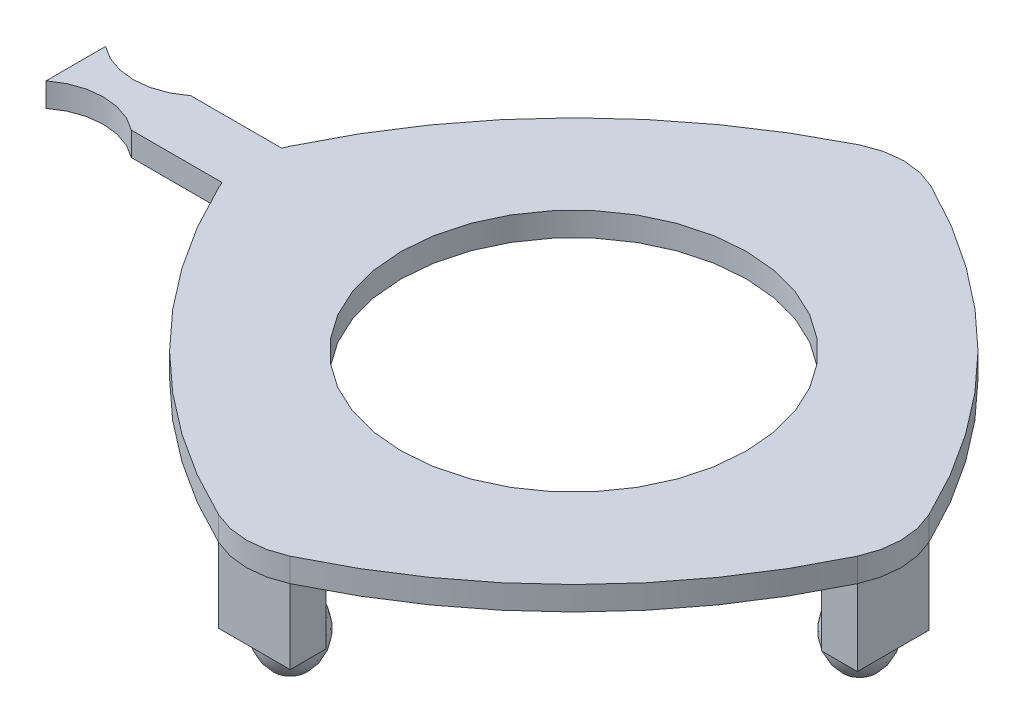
SolidWorks part; units mm, degrees
ref_plane "Front Plane" through (0, 0, 0) normal (0, 0, 1) x (1, 0, 0)
ref_plane "Top Plane" through (0, 0, 0) normal (0, 1, 0) x (1, 0, 0)
ref_plane "Right Plane" through (0, 0, 0) normal (1, 0, 0) x (0, 0, -1)
sketch "Sketch1" plane through (0, 0, 0) normal (0, 1, 0) x (1, 0, 0)
  circle A0 centre (0, 0) radius 24
  circle A1 centre (0, 0) radius 16
  dimension "D1" = 48
extrude "Boss-Extrude1" add sketch "Sketch1" along normal blind 2
sketch "Sketch2" plane through (0, 2, 0) normal (0, 1, 0) x (1, 0, 0)
  line L0 (0, 0) -> (0, -24) construction
  line L1 (-24, 0) -> (-24, -3) construction
  line L2 (-24, 0) -> (-24, 3) construction
  line L3 (-3, -24) -> (-3, -23.8118) construction
  line L4 (3, -24) -> (3, -23.8118) construction
  line L5 (3, -23.8118) -> (3, -26.8118)
  line L6 (-3, -23.8118) -> (-3, -26.8118)
  line L7 (-3, -26.8118) -> (3, -26.8118)
  line L8 (0, 0) -> (-24, 0) construction
  line L9 (-24, 0) -> (24, 0) construction
  line L10 (24, 0) -> (24, -3) construction
  line L11 (24, 0) -> (24, 3) construction
  line L12 (24, -3) -> (-24, -3) construction
  line L13 (24, 3) -> (-24, 3) construction
  line L14 (23.8118, -3) -> (26.8118, -3)
  line L15 (23.8118, 3) -> (26.8118, 3)
  line L16 (26.8118, 3) -> (26.8118, -3)
  line L17 (-23.8118, -3) -> (-26.8118, -3)
  line L18 (-26.8118, -3) -> (-26.8118, 3)
  line L19 (-26.8118, 3) -> (-23.7753, 3)
  line L20 (3, 23.8118) -> (3, 26.8118)
  line L21 (-3, 26.8118) -> (3, 26.8118)
  line L22 (-3, 23.8118) -> (-3, 26.8118)
  line L23 (0, 24) -> (0, 0) construction
  arc A0 (24, 0) -> (23.8118, 3) centre (0, 0) ccw
  arc A1 (-3, -23.8118) -> (3, -23.8118) centre (0, 0) ccw
  arc A2 (-3, -23.8118) -> (3, -23.8118) centre (0, 0) ccw
  arc A3 (-23.8118, 3) -> (-24, 0) centre (0, 0) ccw
  arc A4 (23.8118, -3) -> (23.8118, 3) centre (0, 0) ccw
  arc A5 (23.8118, -3) -> (22.9513, 7.0169) centre (0, 0) ccw
  arc A6 (-23.8118, 3) -> (3, -23.8118) centre (0, 0) ccw
  arc A7 (3, 23.8118) -> (-3, 23.8118) centre (0, 0) ccw
  arc A8 (3, 23.8118) -> (-3, 23.8118) centre (0, 0) ccw
  arc A9 (3, 23.8118) -> (-3, 23.8118) centre (0, 0) ccw
  arc A10 (3, 23.8118) -> (-3, 23.8118) centre (0, 0) ccw
  arc A11 (-23.8118, 3) -> (22.9513, 7.0169) centre (0, 0) ccw
  arc A12 (-23.8118, 3) -> (-23.8118, -3) centre (0, 0) ccw
  dimension "D1" = 6
  dimension "D2" = 3
  dimension "D3" = 6
  dimension "D4" = 3
extrude "Boss-Extrude2" add sketch "Sketch2" against normal blind 5
sketch "Croquis1" plane through (0, 0, 0) normal (1, 0, 0) x (0, 0, -1)
  line L0 (-23.8118, -3) -> (-23.8118, -9.5)
  line L1 (-23.8118, -6.25) -> (-21.312, -6.25) construction
  line L2 (-23.8118, -9.5) -> (-23.8118, 5.1699) construction
  arc A0 (-23.8118, -9.5) -> (-23.8118, -3) centre (-24.6746, -6.25) ccw
  point P6 (-23.8118, -6.25)
  dimension "D1" = 6.5
  dimension "D2" = 2.4997
revolve "Revolución1" add sketch "Croquis1" angle 360 about L2
sketch3d "Croquis3D1"
  line L0 (-24, 0, 0) -> (-24, -3, 0) construction
  line L1 (-24, -3, 0) -> (-24, -9.5, 0)
  line L2 (-24, -6.25, 0) -> (-24, -6.25, 2.5) construction
  arc A0 (-23.8118, 0, -3) -> (-23.8118, 0, 3) centre (0, 0, 0) ccw construction
  arc A1 (-23.8118, -3, -3) -> (-23.8118, -3, 3) centre (0, -3, 0) ccw construction
  arc A2 (-24, -9.5, 0) -> (-24, -3, 0) centre (-24, -6.25, -0.8625) cw
  point P5 (0, 24, 0)
  point P9 (0, 21, 0)
  point P14 (-27.3625, -6.25, -0.8625)
revolve "Revolución2" add sketch "Croquis3D1" angle 360 about L1
sketch3d "Croquis3D2"
  line L0 (24, -6.25, 0) -> (24, -6.25, 2.5) construction
  line L1 (24, -3, 0) -> (24, -9.5, 0)
  line L2 (24, -3, 0) -> (24, 0, 0) construction
  arc A1 (23.8118, -3, 3) -> (23.8118, -3, -3) centre (0, -3, 0) ccw construction
  arc A2 (24, -9.5, 0) -> (24, -3, 0) centre (24, -6.25, -0.8625) cw
  arc A3 (23.8118, 0, 3) -> (23.8118, 0, -3) centre (0, 0, 0) ccw construction
  point P4 (20.6375, -6.25, -0.8625)
  point P9 (0, 21, 0)
  point P14 (0, 24, 0)
revolve "Revolución3" add sketch "Croquis3D2" angle 360 about L1
sketch "Croquis2" plane through (-3, 0, 0) normal (-1, 0, 0) x (0, 0, 1)
  line L0 (26.8118, -3) -> (23.8118, -3)
  line L1 (23.8118, -3) -> (23.8118, -6.25)
  line L2 (23.8118, -6.25) -> (26.8118, -6.25)
  line L3 (26.8118, -6.25) -> (26.8118, -3)
extrude "Saliente-Extruir1" add sketch "Croquis2" against normal blind 6
sketch "Croquis4" plane through (0, 0, -3) normal (0, 0, -1) x (-1, 0, 0)
  line L0 (26.8118, -3) -> (23.8118, -3)
  line L1 (23.8118, -3) -> (23.8118, -6.2446)
  line L2 (23.8118, -6.2446) -> (26.8118, -6.2446)
  line L3 (26.8118, -6.2446) -> (26.8118, -3)
extrude "Saliente-Extruir2" add sketch "Croquis4" against normal blind 6
sketch "Croquis6" plane through (0, 0, -3) normal (0, 0, -1) x (-1, 0, 0)
  line L0 (-26.8118, -3) -> (-23.8118, -3)
  line L1 (-23.8118, -3) -> (-26.8118, -3) construction
  line L2 (-23.8118, -3) -> (-23.8118, 0) construction
  line L3 (-23.8118, -3) -> (-23.8118, -6.3919)
  line L4 (-23.8118, -6.3919) -> (-26.8118, -6.3919)
  line L5 (-26.8118, -6.3919) -> (-26.8118, -3)
extrude "Saliente-Extruir3" add sketch "Croquis6" against normal blind 6
sketch "Croquis7" plane through (0, 2, 0) normal (0, 1, 0) x (1, 0, 0)
  line L4 (26.8118, 3) -> (26.8118, -3) construction
  arc A1 (3, -23.8118) -> (23.8118, -3) centre (0, 0) ccw construction
  arc A2 (23.8118, 3) -> (-23.8118, 3) centre (0, 0) ccw construction
  arc A3 (-23.8118, -3) -> (-3, -23.8118) centre (0, 0) ccw construction
  arc A4 (16.9706, -16.9706) -> (3, -26.8118) centre (-18.3891, 18.3891) cw
  arc A5 (3, -26.8118) -> (-3, -26.8118) centre (0, -20.472) cw
  arc A6 (-3, -26.8118) -> (-16.9706, -16.9706) centre (18.3891, 18.3891) cw
  arc A7 (-16.9706, -16.9706) -> (-26.8118, -3) centre (18.3891, 18.3891) cw
  arc A8 (-26.8118, -3) -> (-26.8118, 3) centre (-20.472, 0) cw
  arc A9 (-26.8118, 3) -> (-16.9706, 16.9706) centre (18.3891, -18.3891) cw
  arc A10 (16.9706, -16.9706) -> (26.8118, -3) centre (-18.3891, 18.3891) ccw
  arc A11 (26.8118, -3) -> (26.8118, 3) centre (20.472, 0) ccw
  arc A12 (26.8118, 3) -> (16.9706, 16.9706) centre (-18.3891, -18.3891) ccw
  arc A13 (-16.9706, 16.9706) -> (16.9706, 16.9706) centre (0, 0) ccw
extrude "Saliente-Extruir4" add sketch "Croquis7" against normal blind 2 contours A4 M5 M4 | A5 M3 | A6 M2 M1 | A10 M5 M6 | A11 M7 | A12 M8 M9 | A9 M10 M9 | A7 M1 M12 | A8 M11
sketch "Croquis8" plane through (0, 2, 0) normal (0, 1, 0) x (1, 0, 0)
  line L0 (-27.4857, 0) -> (-16, 0) construction
  line L2 (-27.4857, -2.5) -> (-16, -2.5)
  line L3 (-16, -2.5) -> (-16, 0)
  line L4 (-16, 0) -> (-16, 2.5)
  line L5 (-16, 2.5) -> (-34.651, 2.5)
  line L6 (-41.8163, 2.5) -> (-41.8163, -2.5)
  line L7 (-34.651, -2.5) -> (-27.4857, -2.5)
  arc A0 (-26.8118, 3) -> (-26.8118, -3) centre (-20.472, 0) ccw construction
  circle A1 centre (0, 0) radius 16 construction
  arc A2 (-34.651, -2.5) -> (-41.8163, -2.5) centre (-38.2336, -7.0299) ccw
  arc A3 (-34.651, 2.5) -> (-41.8163, 2.5) centre (-38.2336, 7.0091) cw
extrude "Saliente-Extruir5" add sketch "Croquis8" against normal blind 2
sketch "Croquis10" plane through (0, 0, 0) normal (0, -1, 0) x (-1, 0, 0)
  line L0 (0, 24) -> (0, 27) construction
  line L1 (3, 27) -> (-3, 27)
  line L2 (-3, 27) -> (-3, 23.8118)
  line L3 (3, 27) -> (3, 23.8118)
  arc A0 (16.9706, 16.9706) -> (-16.9706, 16.9706) centre (0, 0) ccw construction
  arc A1 (3, 23.8118) -> (-3, 23.8118) centre (0, 0) ccw
  point P9 (0, 27)
extrude "Saliente-Extruir6" add sketch "Croquis10" against normal up to surface (2 mm away) separate body
sketch "Croquis11" plane through (0, 0, 0) normal (0, -1, 0) x (-1, 0, 0)
  line L0 (3, 27) -> (3, 23.8118)
  line L1 (-3, 27) -> (3, 27)
  line L2 (-3, 27) -> (-3, 23.8118)
  arc A0 (3, 23.8118) -> (-3, 23.8118) centre (0, 0) ccw
extrude "Saliente-Extruir7" add sketch "Croquis11" along normal blind 5
sketch "Croquis27" plane through (0, -5, 0) normal (0, -1, 0) x (-1, 0, 0)
  line L0 (0, 24) -> (4.9263, 23.9003) construction
  line L1 (2.5, 24) -> (-2.5, 24)
  arc A0 (-2.5, 24) -> (2.5, 24) centre (0, 24) ccw
  arc A1 (3, 23.8118) -> (-3, 23.8118) centre (0, 0) ccw construction
revolve "Revolución15" add sketch "Croquis27" angle 360 about L1
sketch "Croquis28" plane through (0, 2, 0) normal (0, 1, 0) x (1, 0, 0)
  line L0 (-16.9706, 16.9706) -> (16.9706, -16.9706) construction
  line L1 (16.9706, 16.9706) -> (-16.9706, -16.9706) construction
  line L2 (-3, 27) -> (3, 27) construction
  line L3 (3, 27) -> (3, 23.8118) construction
  arc A0 (3, -26.8118) -> (26.8118, -3) centre (-18.3891, 18.3891) ccw construction
  arc A1 (-26.8118, -3) -> (-3, -26.8118) centre (18.3891, 18.3891) ccw construction
  arc A2 (16.9706, 16.9706) -> (3, 27) centre (-20.5525, -20.5525) ccw
  arc A3 (3, 27) -> (-3, 27) centre (0, 20.943) ccw
  arc A4 (-3, 27) -> (-16.9706, 16.9706) centre (20.5525, -20.5525) ccw
  arc A5 (-16.9706, -16.9706) -> (-16.9706, 16.9706) centre (0, 0) ccw
extrude "Saliente-Extruir8" add sketch "Croquis28" against normal blind 2 contours A2 M9 M10 | A3 M11 | A4 M12 M13
sketch "Croquis29" plane through (0, 2, 0) normal (0, 1, 0) x (1, 0, 0)
  circle A0 centre (0, 0) radius 14.5034
  circle A1 centre (0, 0) radius 16.5
extrude "Saliente-Extruir9" add sketch "Croquis29" against normal blind 2
